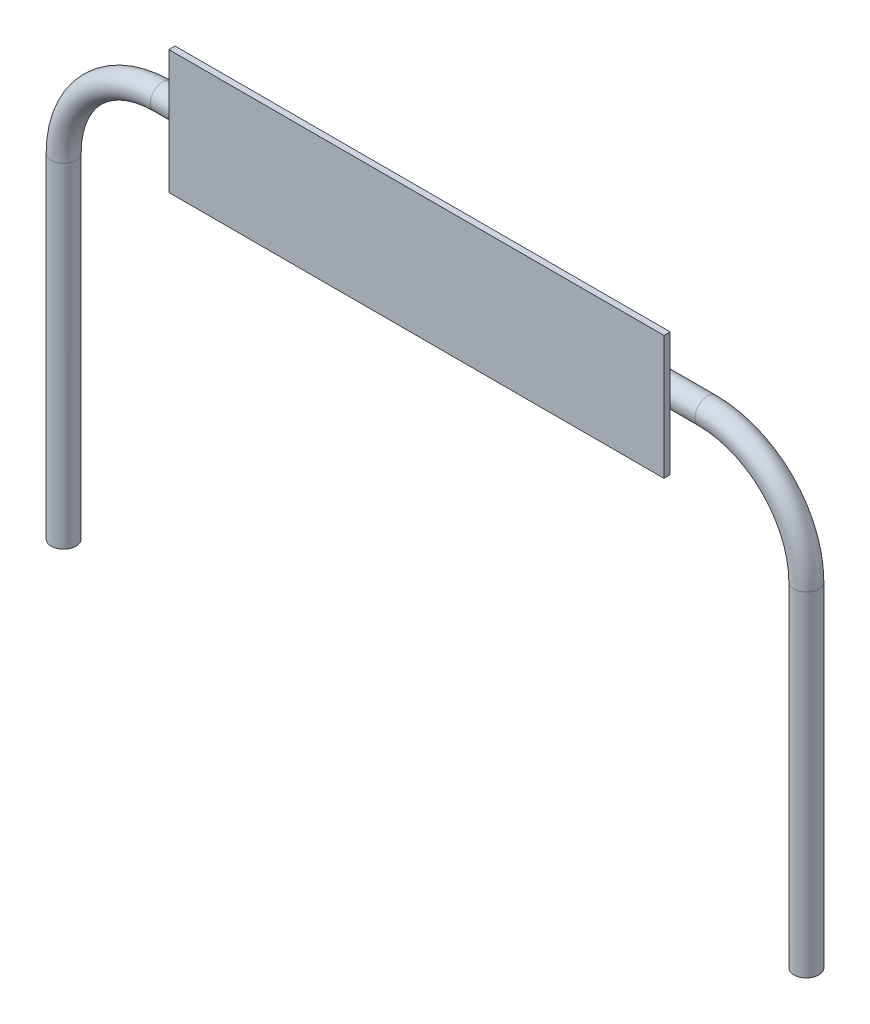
SolidWorks part; units mm, degrees
ref_plane "Front Plane"
ref_plane "Top Plane" through (0, 0, 0) normal (0, 1, 0) x (1, 0, 0)
ref_plane "Right Plane"
sketch "Sketch1" plane through (0, 0, 0) normal (0, 0, 1) x (1, 0, 0)
  line L1 (-6096, -1524) -> (6096, -1524)
  line L2 (-6096, -1524) -> (-6096, 1524)
  line L3 (-6096, 1524) -> (6096, 1524)
  line L4 (6096, -1524) -> (6096, 1524)
  line L5 (-6096, -1524) -> (6096, 1524) construction
  line L6 (-6096, 1524) -> (6096, -1524) construction
  point P0 (0, 0)
  dimension "D1" = 12192
  dimension "D2" = 3048
extrude "Boss-Extrude1" add sketch "Sketch1" along normal blind 152.4 from offset 304.8
sketch "Sketch2" plane through (0, 0, 0) normal (0, 0, 1) x (1, 0, 0)
  line L0 (0, 0) -> (0, -5485.6807) construction
  line L1 (-6705.6, 0) -> (6705.6, 0)
  line L2 (-9144, -2438.4) -> (-9144, -10668)
  line L4 (9144, -2438.4) -> (9144, -10668)
  arc A0 (6705.6, 0) -> (9144, -2438.4) centre (6705.6, -2438.4) cw
  arc A1 (-6705.6, 0) -> (-9144, -2438.4) centre (-6705.6, -2438.4) ccw
  point P9 (9144, 0)
  point P12 (-9144, 0)
  dimension "D3" = 2438.4
  dimension "D1" = 18288
  dimension "D2" = 10668
ref_plane "Plane1" through (0, -10668, 0) normal (0, 1, 0) x (-1, 0, 0)
sketch "Sketch4" plane through (0, -10668, 0) normal (0, 1, 0) x (-1, 0, 0)
  circle A0 centre (-9144, 0) radius 304.8
  dimension "D1" = 609.6
sweep "Sweep2" add profiles "Sketch4" path "Sketch2"
sketch "Sketch5" plane through (0, 0, 0) normal (1, 0, 0) x (0, 0, -1)
  line L0 (0, 304.8) -> (-182.88, 304.8)
  line L1 (-304.8, -1524) -> (-304.8, 1524) construction
  line L2 (0, -304.8) -> (-182.88, -304.8)
  line L3 (-304.8, 0) -> (-304.8, -2438.4) construction
  line L4 (-304.8, 426.72) -> (-304.8, 609.6)
  line L5 (-304.8, -426.72) -> (-304.8, -609.6)
  line L6 (-304.8, 0) -> (-304.8, -2438.4) construction
  line L7 (-213.36, -426.72) -> (-213.36, -609.6)
  line L8 (0, -396.24) -> (-182.88, -396.24)
  line L9 (0, 396.24) -> (-182.88, 396.24)
  line L10 (-213.36, 426.72) -> (-213.36, 609.6)
  line L11 (-213.36, 609.6) -> (-304.8, 609.6)
  line L12 (-213.36, -609.6) -> (-304.8, -609.6)
  circle A0 centre (0, 0) radius 304.8 construction
  arc A1 (0, -304.8) -> (0, 304.8) centre (0, 0) ccw
  arc A2 (-182.88, -304.8) -> (-304.8, -426.72) centre (-182.88, -426.72) ccw
  arc A3 (-182.88, 304.8) -> (-304.8, 426.72) centre (-182.88, 426.72) cw
  arc A4 (-182.88, -396.24) -> (-213.36, -426.72) centre (-182.88, -426.72) ccw
  arc A5 (0, -396.24) -> (0, 396.24) centre (0, 0) ccw
  arc A6 (-182.88, 396.24) -> (-213.36, 426.72) centre (-182.88, 426.72) cw
  point P16 (-304.8, -304.8)
  point P19 (-304.8, 304.8)
  dimension "D2" = 121.92
  dimension "D1" = 304.8
  dimension "D3" = 91.44
extrude "Boss-Extrude4" add sketch "Sketch5" along normal blind 457.2 from offset 2438.4 separate body
mirror "Mirror1"
